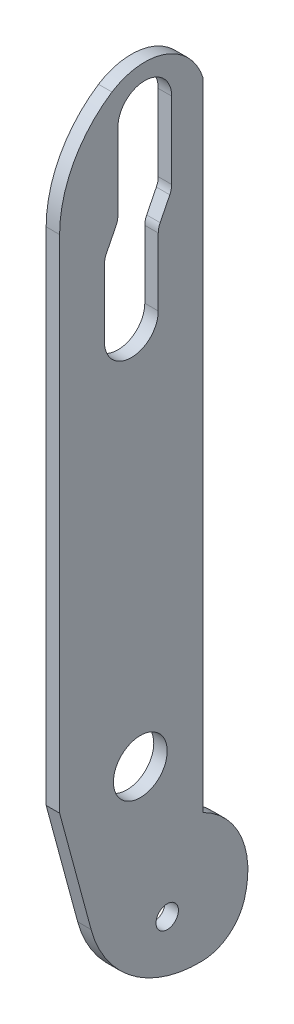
SolidWorks part; units mm, degrees
ref_plane "Plan de face" through (0, 0, 0) normal (0, 0, 1) x (1, 0, 0)
ref_plane "Plan de dessus" through (0, 0, 0) normal (0, 1, 0) x (1, 0, 0)
ref_plane "Plan de droite" through (0, 0, 0) normal (1, 0, 0) x (0, 0, -1)
imported_body "Importée1"
fillet "Congé1" radius 2
